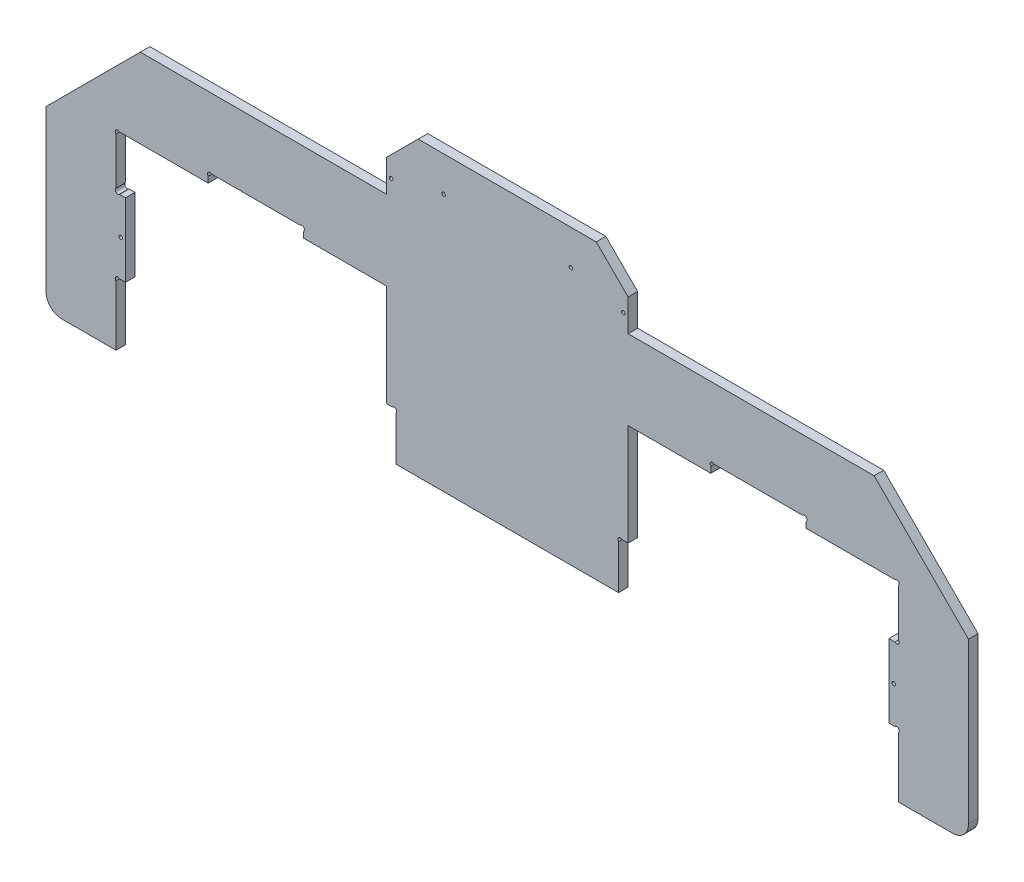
SolidWorks part; units mm, degrees
ref_plane "Plan de face" through (0, 0, 0) normal (0, 0, 1) x (1, 0, 0)
ref_plane "Plan de dessus" through (0, 0, 0) normal (0, 1, 0) x (1, 0, 0)
ref_plane "Plan de droite" through (0, 0, 0) normal (1, 0, 0) x (0, 0, -1)
sketch "Esquisse1" plane through (0, 0, 0) normal (0, 0, 1) x (1, 0, 0)
  line L0 (0, -73.5394) -> (0, 308.8632) construction
  line L1 (290, -73.5394) -> (290, 262.0971) construction
  line L2 (256.0249, 120) -> (212.174, 120) construction
  line L3 (346.4556, 0) -> (-40, 0) construction
  line L4 (329.5923, 200) -> (-38.643, 200) construction
  line L5 (76, -52.8899) -> (76, 272.6787) construction
  line L6 (240, 204.2828) -> (240, -52.8899) construction
  line L7 (346.4556, 250) -> (-75.4584, 250) construction
  line L8 (56, 290) -> (76, 270)
  line L9 (230.7107, 250) -> (290, 190.7107)
  line L10 (-24.218, 106) -> (96.4072, 106) construction
  line L11 (158, 29.6271) -> (158, -21.2823) construction
  line L12 (76, 270) -> (76, 250)
  line L13 (76, 250) -> (230.7107, 250)
  line L14 (246, 120) -> (221.4475, 95.4475) construction
  line L15 (290, 190.7107) -> (290, 90)
  line L16 (243.7373, 200) -> (188, 200)
  line L17 (52.4053, 156) -> (80.1909, 156) construction
  line L18 (52.4053, 136) -> (80.1909, 136) construction
  line L19 (-50.4455, 290) -> (96.4072, 290) construction
  line L20 (-46.1086, 268) -> (96.4072, 268) construction
  line L21 (70, -33.1466) -> (70, 219.4286) construction
  line L22 (246, -33.1466) -> (246, 209.1108) construction
  line L23 (329.5923, 206) -> (36.9159, 206) construction
  line L24 (196.6603, 80) -> (305.5602, 80) construction
  line L25 (-70, 133.7373) -> (-70, 106)
  line L26 (196.6603, 143) -> (256.0249, 143) construction
  line L27 (243.7373, 166) -> (240, 166)
  line L28 (70, 136) -> (95.7133, 110.2867) construction
  line L29 (240, 166) -> (240, 120)
  line L30 (240, 120) -> (243.7373, 120)
  line L31 (246, 197.7373) -> (246, 168.2627)
  line L32 (246, 117.7373) -> (246, 80)
  line L33 (246, 80) -> (280, 80)
  line L34 (246, 200) -> (223.733, 177.733) construction
  line L35 (-86.4767, 260) -> (-56, 260) construction
  line L36 (72.2627, 136) -> (76, 136)
  line L37 (76, 136) -> (76, 200)
  line L38 (128, 206) -> (143.7574, 190.2426) construction
  line L39 (70, 133.7373) -> (70, 106)
  line L40 (158, 200) -> (158, 181.4071) construction
  line L41 (128, 210.6288) -> (128, 181.4071) construction
  line L42 (128, 203.7373) -> (128, 200)
  line L43 (188, 203.7373) -> (188, 200)
  line L44 (130.2627, 206) -> (185.7373, 206)
  line L45 (-230.7107, 250) -> (-290, 190.7107)
  line L46 (128, 200) -> (76, 200)
  line L47 (-290, 190.7107) -> (-290, 90)
  line L48 (-246, 80) -> (-280, 80)
  line L49 (-243.7373, 200) -> (-188, 200)
  line L50 (-246, 117.7373) -> (-246, 80)
  line L51 (-246, 197.7373) -> (-246, 168.2627)
  line L52 (-240, 120) -> (-243.7373, 120)
  line L53 (-240, 166) -> (-240, 120)
  line L55 (70, 200) -> (86.7165, 183.2835) construction
  line L56 (-76, 136) -> (-76, 200)
  line L57 (-72.2627, 136) -> (-76, 136)
  line L59 (-70, 106) -> (70, 106)
  line L60 (-56, 290) -> (-76, 270)
  line L61 (-76, 270) -> (-76, 250)
  line L62 (-243.7373, 166) -> (-240, 166)
  line L63 (-76, 250) -> (-230.7107, 250)
  line L64 (-128, 200) -> (-76, 200)
  line L65 (-130.2627, 206) -> (-185.7373, 206)
  line L66 (-188, 203.7373) -> (-188, 200)
  line L67 (-128, 203.7373) -> (-128, 200)
  line L68 (243, 151.9076) -> (243, 137.7373) construction
  line L69 (-73, 286.9084) -> (-73, 239.7619) construction
  line L73 (40, 278.3561) -> (40, 190.2426) construction
  line L74 (-40, 278.3561) -> (-40, 210.6288) construction
  line L88 (-56, 290) -> (56, 290)
  arc A0 (246, 117.7373) -> (243.7373, 120) centre (244.8686, 118.8686) ccw
  arc A1 (246, 168.2627) -> (243.7373, 166) centre (244.8686, 167.1314) cw
  arc A2 (246, 197.7373) -> (243.7373, 200) centre (244.8686, 198.8686) ccw
  arc A3 (72.2627, 136) -> (70, 133.7373) centre (71.1314, 134.8686) ccw
  arc A4 (280, 80) -> (290, 90) centre (280, 90) ccw
  circle A5 centre (-73, 260) radius 1.1
  circle A6 centre (-40, 268) radius 1.1
  circle A7 centre (73, 260) radius 1.1
  circle A8 centre (40, 268) radius 1.1
  arc A9 (-72.2627, 136) -> (-70, 133.7373) centre (-71.1314, 134.8686) cw
  arc A10 (-280, 80) -> (-290, 90) centre (-280, 90) cw
  arc A11 (-246, 197.7373) -> (-243.7373, 200) centre (-244.8686, 198.8686) cw
  arc A12 (-246, 168.2627) -> (-243.7373, 166) centre (-244.8686, 167.1314) ccw
  arc A13 (-246, 117.7373) -> (-243.7373, 120) centre (-244.8686, 118.8686) cw
  arc A14 (-185.7373, 206) -> (-188, 203.7373) centre (-186.8686, 204.8686) ccw
  arc A15 (-130.2627, 206) -> (-128, 203.7373) centre (-129.1314, 204.8686) cw
  circle A16 centre (243, 143) radius 1.1
  circle A17 centre (-243, 143) radius 1.1
  arc A18 (130.2627, 206) -> (128, 203.7373) centre (129.1314, 204.8686) ccw
  arc A19 (185.7373, 206) -> (188, 203.7373) centre (186.8686, 204.8686) cw
  point P24 (290, 230)
  point P92 (290, 80)
  dimension "D2" = 82
  dimension "D8" = 44
  dimension "D9" = 20
  dimension "D10" = 40
  dimension "D11" = 126
  dimension "D13" = 63
  dimension "D22" = 45
  dimension "D24" = 30
  dimension "D26" = 3
  dimension "D29" = 22
  dimension "D15" = 45
  dimension "D23" = 10
  dimension "D27" = 3
  dimension "D28" = 10
  dimension "D1" = 290
  dimension "D3" = 76
  dimension "D4" = 200
  dimension "D5" = 164
  dimension "D6" = 250
  dimension "D7" = 100
  dimension "D12" = 45
  dimension "D14" = 45
  dimension "D16" = 20
  dimension "D17" = 6
  dimension "D18" = 6
  dimension "D19" = 6
  dimension "D20" = 23
  dimension "D21" = 45
  dimension "D25" = 45
  dimension "D30" = 40
  dimension "D31" = 40
extrude "Boss.-Extru.1" add sketch "Esquisse1" along normal blind 6
